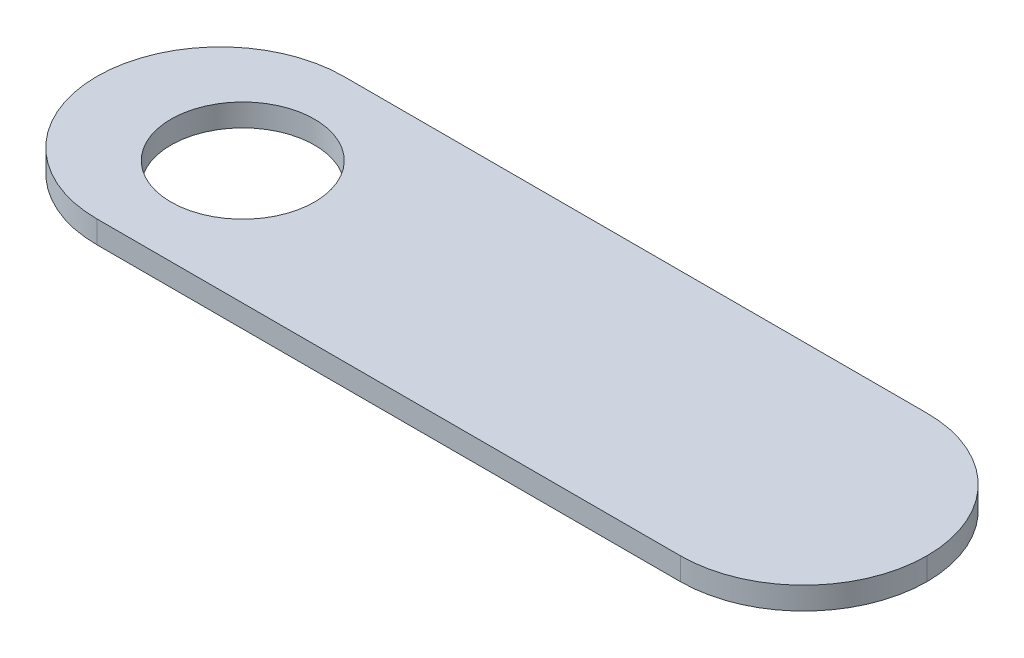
SolidWorks part; units mm, degrees
ref_plane "Front Plane" through (0, 0, 0) normal (0, 0, 1) x (1, 0, 0)
ref_plane "Top Plane" through (0, 0, 0) normal (0, 1, 0) x (1, 0, 0)
ref_plane "Right Plane" through (0, 0, 0) normal (1, 0, 0) x (0, 0, -1)
sketch "Sketch1" plane through (0, 0, 0) normal (0, 1, 0) x (1, 0, 0)
  line L1 (-9.25, -2.75) -> (9.25, -2.75)
  line L2 (-9.25, -2.75) -> (-9.25, 2.75)
  line L3 (-9.25, 2.75) -> (9.25, 2.75)
  line L4 (9.25, -2.75) -> (9.25, 2.75)
  line L5 (-9.25, -2.75) -> (9.25, 2.75) construction
  line L6 (-9.25, 2.75) -> (9.25, -2.75) construction
  point P0 (0, 0)
  dimension "D2" = 18.5
  dimension "D1" = 5.5
extrude "Boss-Extrude1" add sketch "Sketch1" along normal blind 0.5
hole_wizard "Ø3.2 (3.2) Diameter Hole1" positions "Sketch3" profile "Sketch2" hole size "Ø3.2" standard "ANSI Metric"
sketch "Sketch3" plane through (0, 0.5, 0) normal (0, 1, 0) x (1, 0, 0)
  line L1 (0, 0) -> (-6, 0) construction
  point P0 (-6, 0)
  dimension "D1" = 6
sketch "Sketch2" plane through (-6, 0.5, 0) normal (1, 0, 0) x (0, 0, 1)
  line L0 (0, 0) -> (0, 0.5)
  line L1 (0, 0.5) -> (1.6, 0.5)
  line L2 (1.6, 0.5) -> (1.6, 0)
  line L5 (1.6, 0) -> (0, 0)
  line L11 (0, -6.35) -> (0, 107.95) construction
  dimension "Thru Hole Dia." = 3.2
  dimension "Thru Hole Depth" = 0.5
fillet "Fillet1" radius 2.75 4 edges at (-9.25, 0.25, -2.75) (-9.25, 0.25, 2.75) (9.25, 0.25, 2.75) (9.25, 0.25, -2.75)
